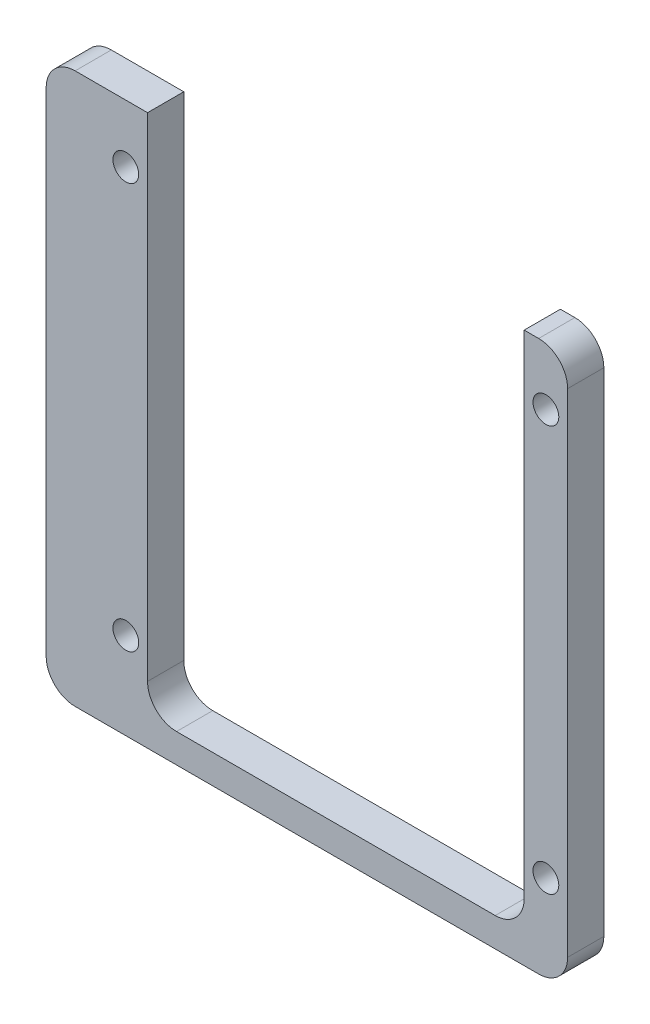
SolidWorks part; units mm, degrees
ref_plane "Front Plane" through (0, 0, 0) normal (0, 0, 1) x (1, 0, 0)
ref_plane "Top Plane" through (0, 0, 0) normal (0, 1, 0) x (1, 0, 0)
ref_plane "Right Plane" through (0, 0, 0) normal (1, 0, 0) x (0, 0, -1)
sketch "Sketch1" plane through (0, 0, 0) normal (0, 0, 1) x (1, 0, 0)
  line L1 (-22.86, 24.13) -> (22.86, 24.13)
  line L2 (-22.86, 24.13) -> (-22.86, -24.13)
  line L3 (-22.86, -24.13) -> (22.86, -24.13)
  line L4 (22.86, 24.13) -> (22.86, -24.13)
  line L5 (-22.86, 24.13) -> (22.86, -24.13) construction
  line L6 (-22.86, -24.13) -> (22.86, 24.13) construction
  point P0 (0, 0)
  dimension "D1" = 45.72
  dimension "D2" = 48.26
extrude "Boss-Extrude1" add sketch "Sketch1" along normal blind 3.175
sketch "Sketch2" plane through (0, 0, 3.175) normal (0, 0, 1) x (1, 0, 0)
  line L0 (2.54, 24.13) -> (2.54, -24.13) construction
  line L1 (22.86, 24.13) -> (-22.86, 24.13) construction
  line L2 (-22.86, -24.13) -> (22.86, -24.13) construction
  line L4 (0, -24.13) -> (0, 25.5487) construction
  line L5 (-13.97, 24.13) -> (19.05, 24.13)
  line L6 (-13.97, 24.13) -> (-13.97, -21.59)
  line L7 (-13.97, -21.59) -> (19.05, -21.59)
  line L8 (19.05, 24.13) -> (19.05, -21.59)
  line L9 (-13.97, 24.13) -> (19.05, -21.59) construction
  line L10 (-13.97, -21.59) -> (19.05, 24.13) construction
  point P8 (2.54, 1.27)
  dimension "D1" = 2.54
  dimension "D2" = 33.02
  dimension "D3" = 45.72
  dimension "D4" = 22.86
extrude "Cut-Extrude1" cut sketch "Sketch2" against normal through all
hole_wizard "#2 Clearance Hole1" positions "Sketch3" profile "Sketch4" hole size "#2" standard "ANSI Inch"
sketch "Sketch3" plane through (0, 0, 3.175) normal (0, 0, 1) x (1, 0, 0)
  line L0 (20.955, 24.13) -> (20.955, -24.13) construction
  line L1 (22.86, 24.13) -> (19.05, 24.13) construction
  line L2 (-22.86, -24.13) -> (22.86, -24.13) construction
  line L5 (-15.875, 24.13) -> (-15.875, -24.13) construction
  line L6 (-13.97, 24.13) -> (-22.86, 24.13) construction
  line L8 (-13.97, 24.13) -> (-13.97, -21.59) construction
  line L9 (-22.86, 19.05) -> (22.86, 19.05) construction
  line L10 (-22.86, 24.13) -> (-22.86, -24.13) construction
  line L11 (22.86, -24.13) -> (22.86, 24.13) construction
  line L13 (-22.86, -16.51) -> (22.86, -16.51) construction
  line L15 (-13.97, -21.59) -> (19.05, -21.59) construction
  point P32 (-15.875, 19.05)
  point P34 (-15.875, -16.51)
  point P36 (20.955, 19.05)
  point P38 (20.955, -16.51)
  dimension "D1" = 1.905
  dimension "D2" = 5.08
  dimension "D3" = 5.08
sketch "Sketch4" plane through (20.955, -16.51, 3.175) normal (1, 0, 0) x (0, -1, 0)
  line L0 (0, 0) -> (0, 3.175)
  line L1 (0, 3.175) -> (1.1303, 3.175)
  line L2 (1.1303, 3.175) -> (1.1303, 0)
  line L5 (1.1303, 0) -> (0, 0)
  line L11 (0, -6.35) -> (0, 107.95) construction
  dimension "Thru Hole Dia." = 2.2606
  dimension "Thru Hole Depth" = 3.175
fillet "Fillet1" radius 2.54 6 edges at (22.86, -24.13, 1.5875) (-22.86, -24.13, 1.5875) (-22.86, 24.13, 1.5875) (22.86, 24.13, 1.5875) (19.05, -21.59, 1.5875) (-13.97, -21.59, 1.5875)
sketch "Sketch5" plane through (0, 0, 3.175) normal (0, 0, 1) x (1, 0, 0)
  line L16 (-20.32, -24.2316) -> (20.32, -24.2316)
  line L17 (22.9616, -21.59) -> (22.9616, 21.59)
  line L18 (20.32, 24.2316) -> (18.9484, 24.2316)
  line L19 (18.9484, 24.2316) -> (18.9484, -19.05)
  line L20 (16.51, -21.4884) -> (-11.43, -21.4884)
  line L21 (-13.8684, -19.05) -> (-13.8684, 24.2316)
  line L22 (-13.8684, 24.2316) -> (-20.32, 24.2316)
  line L23 (-22.9616, 21.59) -> (-22.9616, -21.59)
  line L24 (-20.32, -24.2316) -> (20.32, -24.2316)
  line L25 (22.9616, -21.59) -> (22.9616, 21.59)
  line L26 (20.32, 24.2316) -> (18.9484, 24.2316)
  line L27 (18.9484, 24.2316) -> (18.9484, -19.05)
  line L28 (16.51, -21.4884) -> (-11.43, -21.4884)
  line L29 (-13.8684, -19.05) -> (-13.8684, 24.2316)
  line L30 (-13.8684, 24.2316) -> (-20.32, 24.2316)
  line L31 (-22.9616, 21.59) -> (-22.9616, -21.59)
  circle A8 centre (-15.875, 19.05) radius 1.0287
  circle A9 centre (-15.875, 19.05) radius 1.0287
  circle A11 centre (-15.875, -16.51) radius 1.0287
  arc A12 (20.32, -24.2316) -> (22.9616, -21.59) centre (20.32, -21.59) ccw
  arc A13 (22.9616, 21.59) -> (20.32, 24.2316) centre (20.32, 21.59) ccw
  arc A14 (16.51, -21.4884) -> (18.9484, -19.05) centre (16.51, -19.05) ccw
  arc A15 (-13.8684, -19.05) -> (-11.43, -21.4884) centre (-11.43, -19.05) ccw
  arc A16 (-20.32, 24.2316) -> (-22.9616, 21.59) centre (-20.32, 21.59) ccw
  arc A17 (-22.9616, -21.59) -> (-20.32, -24.2316) centre (-20.32, -21.59) ccw
  arc A18 (20.32, -24.2316) -> (22.9616, -21.59) centre (20.32, -21.59) ccw
  arc A19 (22.9616, 21.59) -> (20.32, 24.2316) centre (20.32, 21.59) ccw
  arc A20 (16.51, -21.4884) -> (18.9484, -19.05) centre (16.51, -19.05) ccw
  arc A21 (-13.8684, -19.05) -> (-11.43, -21.4884) centre (-11.43, -19.05) ccw
  arc A22 (-20.32, 24.2316) -> (-22.9616, 21.59) centre (-20.32, 21.59) ccw
  arc A23 (-22.9616, -21.59) -> (-20.32, -24.2316) centre (-20.32, -21.59) ccw
  circle A24 centre (-15.875, -16.51) radius 1.0287
  circle A26 centre (20.955, 19.05) radius 1.0287
  circle A27 centre (20.955, 19.05) radius 1.0287
  circle A29 centre (20.955, -16.51) radius 1.0287
  circle A30 centre (20.955, -16.51) radius 1.0287
equation "\"t\"= .125'plywood thickness"
equation "\"kerf\"= .004'laser cutter kerf"
equation "\"D1@Boss-Extrude1\"=\"t\""
equation "\"D2@Sketch5\"=\"kerf\""
equation "\"D3@Sketch5\"=\"kerf\""
equation "\"D1@Sketch5\"=\"kerf\""
equation "\"D5@Sketch5\"=\"kerf\""
equation "\"D4@Sketch5\"=\"kerf\""
